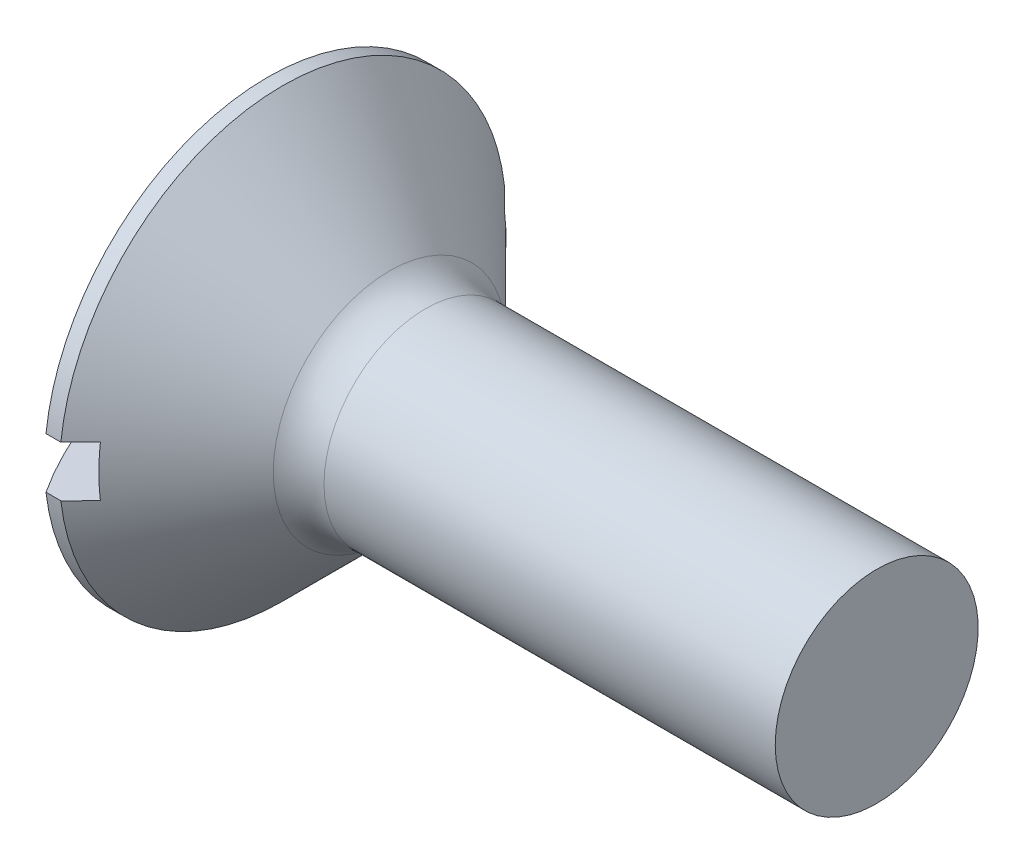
SolidWorks part; units mm, degrees
ref_plane "Front" through (0, 0, 0) normal (0, 0, 1) x (1, 0, 0)
ref_plane "Top" through (0, 0, 0) normal (0, 1, 0) x (1, 0, 0)
ref_plane "Right" through (0, 0, 0) normal (1, 0, 0) x (0, 0, -1)
sketch "Ske-Screw" plane through (0, 0, 0) normal (0, 0, 1) x (1, 0, 0)
  line L0 (0.6593, 2.2) -> (0.8058, 2.2)
  line L1 (0.6593, 0) -> (0, 0)
  line L2 (2.2129, 1) -> (6.6593, 1)
  line L3 (6.6593, 1) -> (6.6593, 0)
  line L4 (6.6593, 0) -> (0.6593, 0)
  line L5 (-1.3499, 0) -> (8.9842, 0) construction
  line L6 (0.8058, 2.2) -> (1.8593, 1.1464)
  arc A0 (0.6593, 2.2) -> (0, 0) centre (4, 0) ccw
  arc A1 (1.8593, 1.1464) -> (2.2129, 1) centre (2.2129, 1.5) ccw
  dimension "rf" = 4
  dimension "r" = 0.5
  dimension "l" = 6
  dimension "dk" = 4.4
  dimension "D3" = 45
  dimension "d" = 2
revolve "Base" add sketch "Ske-Screw" angle 360 about L5
sketch "Ske-Slot" plane through (0, 0, 0) normal (0, 0, 1) x (1, 0, 0)
  line L1 (-1.3728, 0) -> (2.5237, 0) construction
  line L2 (0, -0.25) -> (1, -0.25)
  line L3 (0, -0.25) -> (0, 0.25)
  line L4 (0, 0.25) -> (1, 0.25)
  line L5 (1, -0.25) -> (1, 0.25)
  arc A0 (0.6593, 2.2) -> (0.6593, -2.2) centre (4, 0) ccw construction
  dimension "n" = 0.5
  dimension "t" = 1
extrude "Slot" cut sketch "Ske-Slot" against normal through all and the other way through all
sketch "Sketch1" plane through (0, 0, 0) normal (0, 0, 1) x (1, 0, 0)
  line L0 (5.8578, 0) -> (-1.624, 0) construction
  line L1 (1.8593, 5.7835) -> (5.6593, 5.7835)
  line L2 (1.8593, 5.7835) -> (1.8593, 0.7835)
  line L3 (1.8593, 0.7835) -> (4.9093, 0.7835)
  line L4 (5.6593, 5.7835) -> (5.6593, 1)
  line L6 (0.6593, 2.2) -> (0.6593, 0.25) construction
  line L7 (6.6593, -1) -> (6.6593, 1) construction
  line L9 (2.2129, 1) -> (6.6593, 1) construction
  line L10 (5.6593, 1) -> (4.9093, 0.7835)
  dimension "b" = 1
  dimension "D4" = 5
  dimension "x" = 0.75
sketch "Sketch2" plane through (0, 0, 0) normal (0, 0, 1) x (1, 0, 0)
  line L0 (6.6593, 0.8125) -> (6.7676, 1)
  line L1 (6.7676, 1) -> (6.7676, 1.2165)
  line L2 (6.7676, 1.2165) -> (6.5511, 1.2165)
  line L3 (6.5511, 1.2165) -> (6.5511, 1)
  line L4 (6.5511, 1) -> (6.6593, 0.8125)
  line L5 (0, 0) -> (7.193, 0) construction
  line L6 (6.6593, -1) -> (6.6593, 1) construction
  dimension "D1" = 2
  dimension "D2" = 0.2165
revolve "Cut-Revolve10" [suppressed] cut sketch "Sketch2" angle 360 about L5
pattern_linear "LPattern10" [suppressed] count 14 spacing 0.2598 along (1, 0, 0)
equation "\"D1@Sketch2\" = \"d@Ske-Screw\""
equation "\"D2@Sketch2\" =  ( \"d@Ske-Screw\" - \"D2@ThreadCosmetic1\" )  / 2"
equation "\"D3@LPattern10\" = \"D2@Sketch2\" * 1.2"
equation "\"D1@LPattern10\" = \"D1@ThreadCosmetic1\" / \"D3@LPattern10\" - 1"
